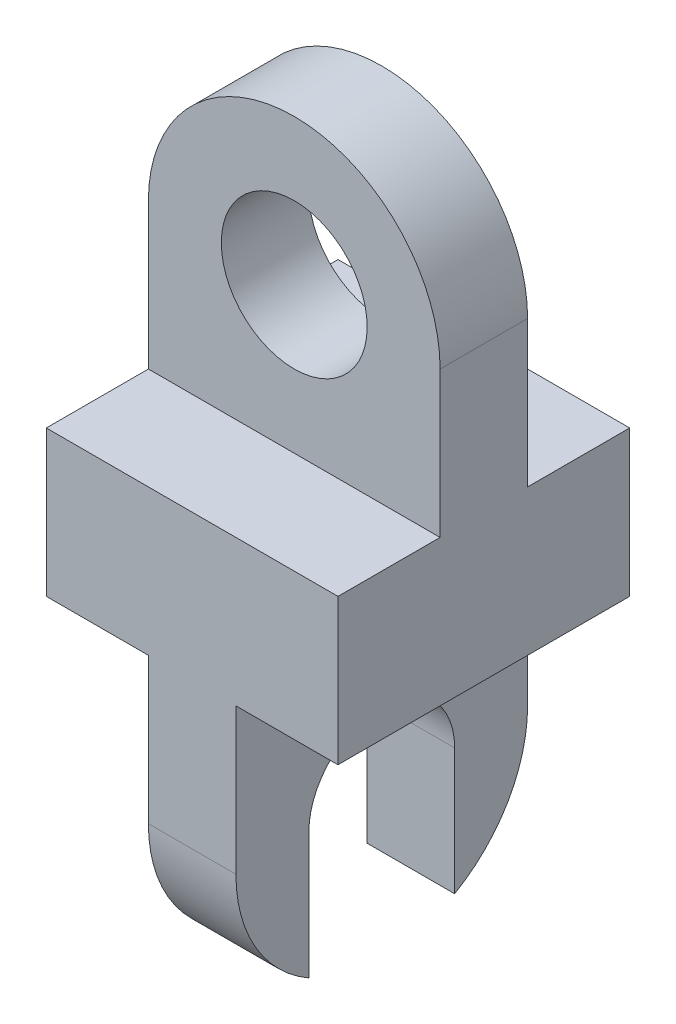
SolidWorks part; units mm, degrees
ref_plane "Alzado" through (0, 0, 0) normal (0, 0, 1) x (1, 0, 0)
ref_plane "Planta" through (0, 0, 0) normal (0, 1, 0) x (1, 0, 0)
ref_plane "Vista lateral" through (0, 0, 0) normal (1, 0, 0) x (0, 0, -1)
sketch "Croquis3" plane through (0, 0, 0) normal (0, 0, 1) x (1, 0, 0)
  line L2 (-50, 100) -> (-50, -100)
  line L3 (-50, -100) -> (50, -100)
  line L4 (50, 100) -> (50, -100)
  arc A0 (50, 100) -> (-50, 100) centre (0, 100) ccw
  point P0 (0, 0)
  point P8 (0, 0)
  dimension "D3" = 100
  dimension "D1" = 100
  dimension "D2" = 200
  dimension "D4" = 50
extrude "Saliente-Extruir1" add sketch "Croquis3" along normal blind 100
sketch "Croquis5" plane through (0, 0, 100) normal (0, 0, 1) x (1, 0, 0)
  line L0 (50, -100) -> (50, 100) construction
  line L2 (-50, 100) -> (-50, 0)
  line L3 (-50, 0) -> (50, 0)
  line L4 (50, 100) -> (50, 0)
  arc A0 (50, 100) -> (-50, 100) centre (0, 100) ccw
  arc A2 (50, 100) -> (-50, 100) centre (0, 100) ccw construction
  point P0 (0, 66.3558)
  point P9 (0, 94.0778)
  point P13 (0, 0)
  dimension "D1" = 100
  dimension "D2" = 100
sketch "Croquis8" plane through (0, 0, 100) normal (0, 0, 1) x (1, 0, 0)
  line L0 (50, 100) -> (50, 0) construction
  line L2 (-50, 100) -> (-50, 50)
  line L3 (-50, 50) -> (50, 50)
  line L4 (50, 100) -> (50, 50)
  arc A0 (50, 100) -> (-50, 100) centre (0, 100) ccw
  arc A1 (50, 100) -> (-50, 100) centre (0, 100) ccw construction
  point P6 (0, 75)
  dimension "D1" = 100
  dimension "D2" = 50
extrude "Cortar-Extruir4" cut sketch "Croquis8" against normal blind 35 and the other way through all
sketch "Croquis9" plane through (0, 0, 0) normal (0, 0, -1) x (-1, 0, 0)
  line L0 (50, 100) -> (50, 0) construction
  line L2 (-50, 100) -> (-50, 50)
  line L3 (-50, 50) -> (50, 50)
  line L4 (50, 100) -> (50, 50)
  arc A0 (50, 100) -> (-50, 100) centre (0, 100) ccw
  arc A1 (50, 100) -> (-50, 100) centre (0, 100) ccw construction
  point P5 (0, 75)
  dimension "D1" = 100
  dimension "D2" = 50
extrude "Cortar-Extruir5" cut sketch "Croquis9" against normal blind 35
sketch "Croquis10" plane through (0, 0, 35) normal (0, 0, -1) x (-1, 0, 0)
  circle A0 centre (0, 100) radius 25
  arc A1 (50, 100) -> (-50, 100) centre (0, 100) ccw construction
  point P5 (0, 0)
  dimension "D1" = 50
extrude "Cortar-Extruir6" cut sketch "Croquis10" against normal through all both and the other way through all
sketch "Croquis11" plane through (-50, 0, 0) normal (-1, 0, 0) x (0, 0, 1)
  point P7 (-10.6411, 99.8609)
sketch "Croquis12" plane through (-50, 0, 0) normal (-1, 0, 0) x (0, 0, 1)
  line L0 (100, 50) -> (100, -100) construction
  line L1 (0, 0) -> (100, 0)
  line L2 (0, 0) -> (0, -100)
  line L3 (0, -100) -> (100, -100)
  line L4 (100, 0) -> (100, -100)
  line L5 (0, 0) -> (100, -100) construction
  line L6 (0, -100) -> (100, 0) construction
  line L9 (100, -100) -> (0, -100) construction
  point P0 (50, -50)
  dimension "D1" = 100
  dimension "D2" = 0
  dimension "D3" = 100
extrude "Cortar-Extruir10" cut sketch "Croquis12" against normal through all and the other way through all
sketch "Croquis17" plane through (-50, 0, 0) normal (-1, 0, 0) x (0, 0, 1)
  line L0 (0, 50) -> (0, 0) construction
  line L1 (0, 0) -> (100, 0) construction
  line L4 (0, 0) -> (100, 0)
  line L5 (0, 0) -> (0, -50)
  line L7 (100, 0) -> (100, -50)
  arc A0 (0, -50) -> (100, -50) centre (50, -50) ccw
  dimension "D1" = 100
  dimension "D2" = 50
extrude "Saliente-Extruir3" add sketch "Croquis17" against normal blind 100
sketch "Croquis22" plane through (-50, 0, 0) normal (-1, 0, 0) x (0, 0, 1)
  line L0 (0, 50) -> (0, -50) construction
  line L1 (0, 0) -> (100, 0)
  line L2 (0, 0) -> (0, -100)
  line L3 (0, -100) -> (100, -100)
  line L4 (100, 0) -> (100, -100)
  arc A0 (0, -50) -> (100, -50) centre (50, -50) ccw construction
  dimension "D1" = 100
  dimension "D2" = 100
extrude "Cortar-Extruir12" cut sketch "Croquis22" against normal blind 35
sketch "Croquis23" plane through (50, 0, 0) normal (1, 0, 0) x (0, 0, -1)
  line L0 (-100, -50) -> (-100, 50) construction
  line L1 (-100, 0) -> (0, 0)
  line L2 (-100, 0) -> (-100, -100)
  line L3 (-100, -100) -> (0, -100)
  line L4 (0, 0) -> (0, -100)
  arc A0 (-100, -50) -> (0, -50) centre (-50, -50) ccw construction
  dimension "D1" = 100
  dimension "D2" = 100
extrude "Cortar-Extruir13" cut sketch "Croquis23" against normal blind 35
sketch "Croquis24" plane through (-15, 0, 0) normal (-1, 0, 0) x (0, 0, 1)
  line L0 (0, 0) -> (0, -50) construction
  line L1 (65, 150) -> (35, 150) construction
  line L4 (25, -50) -> (25, -110.4288)
  line L5 (25, -110.4288) -> (75, -110.4288)
  line L6 (75, -50) -> (75, -110.4288)
  arc A0 (75, -50) -> (25, -50) centre (50, -50) ccw
  dimension "D1" = 50
  dimension "D2" = 50
  dimension "D3" = 200
  dimension "D4" = 50
  dimension "D5" = 60.4288
extrude "Cortar-Extruir14" cut sketch "Croquis24" against normal through all both and the other way through all
